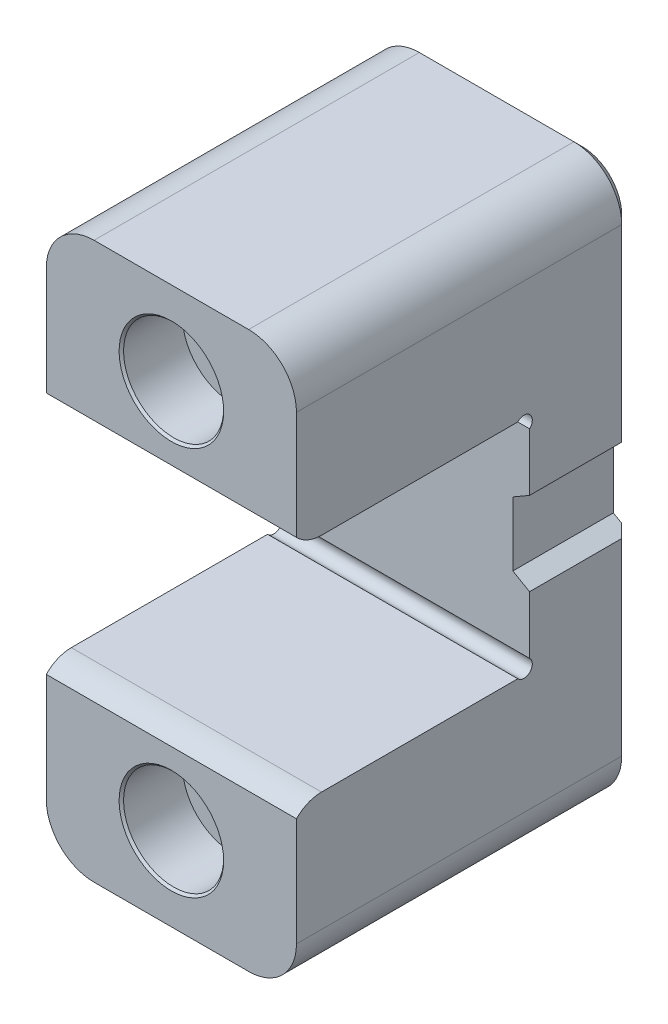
SolidWorks part; units mm, degrees
ref_plane "Front Plane" through (0, 0, 0) normal (0, 0, 1) x (1, 0, 0)
ref_plane "Top Plane" through (0, 0, 0) normal (0, 1, 0) x (1, 0, 0)
ref_plane "Right Plane" through (0, 0, 0) normal (1, 0, 0) x (0, 0, -1)
sketch "Sketch1" plane through (0, 0, 0) normal (1, 0, 0) x (0, 0, -1)
  line L0 (0, 0) -> (50000, 0) construction
  line L1 (0, 20) -> (41.92, 20)
  line L2 (0, 50) -> (60, 50)
  line L3 (0, 50) -> (0, 20)
  line L4 (0, -50) -> (60, -50)
  line L5 (60, 50) -> (60, -50)
  line L6 (41.92, 20) -> (41.92, -20)
  line L7 (41.92, -20) -> (0, -20)
  line L9 (0, 19.8) -> (0, -19.8) construction
  line L10 (0, -20) -> (0, -50)
  dimension "D1" = 60
  dimension "D2" = 100
  dimension "D3" = 41.92
  dimension "D4" = 40
extrude "Extrude1" add sketch "Sketch1" along normal mid plane 45
fillet "Fillet1" radius 8.6 4 edges at (-22.5, -50, -30) (-22.5, 50, -30) (22.5, -50, -30) (22.5, 50, -30)
sketch "Sketch2" plane through (-12, 0, 0) normal (0, 0, 1) x (1, 0, 0)
  line L0 (0, 0) -> (50000, 0) construction
  line L1 (34.5, 20) -> (34.5, -20) construction
  line L6 (31.5, -5.7679) -> (34.5, -7.5)
  line L10 (34.5, -7.5) -> (34.5, 7.5)
  line L11 (31.5, 5.7679) -> (34.5, 7.5)
  line L12 (31.5, -5.7679) -> (31.5, 5.7679)
  dimension "D1" = 15
  dimension "D2" = 3
  dimension "D3" = 30
extrude "Cut-Extrude1" cut sketch "Sketch2" against normal through all
sketch "Sketch5" plane through (22.5, 0, 0) normal (1, 0, 0) x (0, 0, -1)
  line L0 (0, 0) -> (50000, 0) construction
  line L1 (0, 20) -> (41.92, 20) construction
  line L2 (0, 41.4) -> (0, 20) construction
  line L3 (0, -20) -> (0, -41.4) construction
  line L4 (-5.5, -11.917) -> (4.5, -11.917)
  line L5 (-5.5, -11.917) -> (-5.5, -21.917)
  line L6 (-5.5, -21.917) -> (0, -21.917)
  line L7 (4.5, -11.917) -> (4.5, -20)
  line L8 (41.92, -20) -> (0, -20) construction
  line L9 (4.5, 11.917) -> (4.5, 20)
  line L10 (-5.5, 21.917) -> (0, 21.917)
  line L11 (-5.5, 11.917) -> (-5.5, 21.917)
  line L12 (-5.5, 11.917) -> (4.5, 11.917)
  arc A0 (1.0909, -20.4739) -> (4.5, -20) centre (4.5, -32.5) cw construction
  arc A1 (0, -21.917) -> (1.0909, -20.4739) centre (1.5, -21.917) cw construction
  arc A2 (0, 21.917) -> (1.0909, 20.4739) centre (1.5, 21.917) ccw construction
  arc A3 (1.0909, 20.4739) -> (4.5, 20) centre (4.5, 32.5) ccw construction
  arc A4 (0, 21.917) -> (4.5, 20) centre (4.5, 26.2402) ccw
  arc A5 (0, -21.917) -> (4.5, -20) centre (4.5, -26.2402) cw
  dimension "D1" = 1.5
  dimension "D2" = 12.5
  dimension "D3" = 10
  dimension "D4" = 10
  dimension "D5" = 4.5
extrude "Cut-Extrude2" cut sketch "Sketch5" against normal through all
sketch "Sketch6" plane through (22.5, 0, 0) normal (1, 0, 0) x (0, 0, -1)
  line L0 (0, 0) -> (50000, 0) construction
  line L3 (41.92, 20) -> (41.92, 7.5) construction
  line L4 (4.5, 20) -> (41.92, 20) construction
  circle A0 centre (40.92, 19) radius 1.5
  circle A1 centre (40.92, -19) radius 1.5
  dimension "D2" = 0.5
  dimension "D3" = 1.5
  dimension "D1" = 0.5
extrude "Cut-Extrude3" cut sketch "Sketch6" against normal through all
hole_wizard "CBORE for M10 SHCS1" positions "Sketch8" profile "Sketch7" counterbore size "M10" standard "Ansi Metric"
sketch "Sketch8" plane through (0, 0, 0) normal (0, 0, 1) x (1, 0, 0)
  line L0 (0, 0) -> (50000, 0) construction
  point P0 (0, 35)
  point P5 (0, -35)
  dimension "D1" = 70
sketch "Sketch7" plane through (0, 35, 0) normal (1, 0, 0) x (0, -1, 0)
  line L0 (0, 0) -> (0, 60)
  line L1 (0, 60) -> (5.5, 60)
  line L3 (5.5, 60) -> (5.5, 11)
  line L4 (5.5, 11) -> (9, 11)
  line L5 (9, 11) -> (9, 0)
  line L7 (9, 0) -> (0, 0)
  line L11 (0, -6.35) -> (0, 107.95) construction
  dimension "Thru Hole Dia." = 11
  dimension "Thru Hole Depth" = 60
  dimension "C'Bore Dia." = 18
  dimension "C'Bore Depth" = 11
chamfer "Chamfer1" distance 1.5 angle 45 9 edges at (-22.5, 0, -60) (-19.9811, -47.4811, -60) (0, -50, -60) (0, 50, -60) (-19.9811, 47.4811, -60) (19.9811, -47.4811, -60) (22.5, 24.45, -60) (22.5, -24.45, -60) (19.9811, 47.4811, -60)
chamfer "Chamfer3" distance 0.4 angle 45 2 edges at (9, -35, 0) (9, 35, 0)
